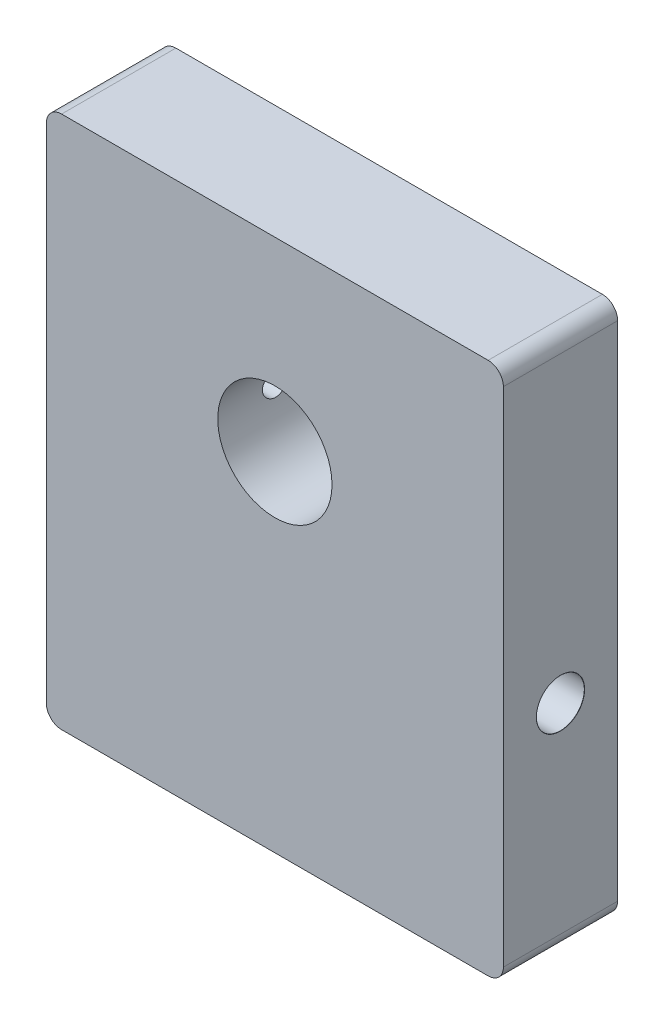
SolidWorks part; units mm, degrees
ref_plane "Front Plane" through (0, 0, 0) normal (0, 0, 1) x (1, 0, 0)
ref_plane "Top Plane" through (0, 0, 0) normal (0, 1, 0) x (1, 0, 0)
ref_plane "Right Plane" through (0, 0, 0) normal (1, 0, 0) x (0, 0, -1)
sketch "Sketch1" plane through (0, 0, 0) normal (0, 0, 1) x (1, 0, 0)
  line L1 (0, 0) -> (76.2, 0)
  line L2 (0, 0) -> (0, 88.9)
  line L3 (0, 88.9) -> (76.2, 88.9)
  line L4 (76.2, 0) -> (76.2, 88.9)
  dimension "D1" = 76.2
  dimension "D2" = 88.9
extrude "Boss-Extrude1" add sketch "Sketch1" along normal blind 19.05
sketch "Sketch2" plane through (0, 0, 19.05) normal (0, 0, 1) x (1, 0, 0)
  line L0 (0, 0) -> (76.2, 0) construction
  line L1 (0, 88.9) -> (0, 0) construction
  circle A0 centre (38.1, 57.912) radius 9.525
  dimension "D3" = 19.05
  dimension "D1" = 57.912
  dimension "D2" = 38.1
extrude "Cut-Extrude1" cut sketch "Sketch2" against normal through all contours A0
hole_wizard "Ø8.0mm Dowel Hole1" positions "Sketch6" profile "Sketch5" hole size "Ø8.0" standard "ANSI Metric"
sketch "Sketch6" plane through (76.2, 0, 0) normal (1, 0, 0) x (0, 0, -1)
  line L0 (-9.525, 0) -> (-9.525, 59.6474) construction
  line L1 (-19.05, 0) -> (0, 0) construction
  point P0 (-9.525, 35.8934)
sketch "Sketch5" plane through (76.2, 35.8934, 9.525) normal (0, 1, 0) x (0, 0, -1)
  line L0 (0, 0) -> (0, 27.8034)
  line L1 (0, 27.8034) -> (4, 25.4)
  line L2 (4, 25.4) -> (4, 0.025)
  line L3 (4, 0.025) -> (4.025, 0)
  line L5 (4.025, 0) -> (0, 0)
  line L6 (-4, 0.025) -> (-4.025, 0) construction
  line L10 (0, 27.8034) -> (-4, 25.4) construction
  line L11 (0, -6.35) -> (0, 107.95) construction
  dimension "Hole Dia." = 8
  dimension "Hole Depth" = 25.4
  dimension "Near C'Sink Dia." = 8.05
  dimension "Near C'Sink Angle" = 90
  dimension "Drill Angle" = 118
sketch "Sketch7" plane through (0, 0, 19.05) normal (0, 0, 1) x (1, 0, 0)
  line L1 (38.1, 63.5) -> (76.2, 63.5)
  line L2 (38.1, 63.5) -> (38.1, 88.9)
  line L3 (38.1, 88.9) -> (76.2, 88.9)
  line L4 (76.2, 63.5) -> (76.2, 88.9)
  dimension "D1" = 38.1
  dimension "D2" = 25.4
extrude "Cut-Extrude2" [suppressed] cut sketch "Sketch7" against normal through all
fillet "Fillet1" radius 2.54 4 edges at (0, 0, 9.525) (76.2, 0, 9.525) (76.2, 88.9, 9.525) (0, 88.9, 9.525)
sketch "Sketch10" plane through (0, 0, 19.05) normal (0, 0, 1) x (1, 0, 0)
  line L0 (50.8, 88.9) -> (50.8, 76.2)
  line L1 (73.66, 88.9) -> (2.54, 88.9) construction
  line L2 (50.8, 76.2) -> (76.2, 76.2)
  line L3 (76.2, 2.54) -> (76.2, 86.36) construction
  line L4 (76.2, 76.2) -> (76.2, 86.36)
  line L6 (73.66, 88.9) -> (50.8, 88.9)
  line L8 (76.2, 86.36) -> (76.2, 88.9)
  line L9 (76.2, 88.9) -> (73.66, 88.9)
  dimension "D1" = 12.7
  dimension "D2" = 25.4
sketch "Sketch11" plane through (0, 0, 0) normal (0, -1, 0) x (1, 0, 0)
  line L0 (73.66, 9.525) -> (2.54, 9.525) construction
  line L1 (73.66, 0) -> (73.66, 19.05) construction
  line L2 (2.54, 19.05) -> (2.54, 0) construction
  line L3 (38.1, 0) -> (38.1, 19.05) construction
  line L4 (2.54, 0) -> (73.66, 0) construction
  line L5 (2.54, 19.05) -> (73.66, 19.05) construction
hole_wizard "Ø8.2 (8.2) Diameter Hole1" positions "Sketch12" profile "Sketch13" hole size "Ø8.2" standard "ANSI Metric"
sketch "Sketch12" plane through (0, 0, 0) normal (0, -1, 0) x (-1, 0, 0)
  line L0 (-73.66, -9.525) -> (-2.54, -9.525) construction
  point P0 (-38.1, -9.525)
sketch "Sketch13" plane through (38.1, 0, 9.525) normal (1, 0, 0) x (0, 0, -1)
  line L0 (0, 0) -> (0, 27.8635)
  line L1 (0, 27.8635) -> (4.1, 25.4)
  line L2 (4.1, 25.4) -> (4.1, 0.025)
  line L3 (4.1, 0.025) -> (4.125, 0)
  line L5 (4.125, 0) -> (0, 0)
  line L6 (-4.1, 0.025) -> (-4.125, 0) construction
  line L10 (0, 27.8635) -> (-4.1, 25.4) construction
  line L11 (0, -6.35) -> (0, 107.95) construction
  dimension "Hole Dia." = 8.2
  dimension "Hole Depth" = 25.4
  dimension "Near C'Sink Dia." = 8.25
  dimension "Near C'Sink Angle" = 90
  dimension "Drill Angle" = 118
sketch "Sketch14" plane through (0, 0, 0) normal (-1, 0, 0) x (0, 0, 1)
  line L0 (0, 2.54) -> (19.05, 2.54) construction
  line L1 (9.525, 2.54) -> (9.525, 90.1429) construction
  line L2 (0, 88.9) -> (19.05, 88.9) construction
  circle A0 centre (9.525, 58.42) radius 2.0998
  dimension "D1" = 30.48
extrude "Cut-Extrude3" cut sketch "Sketch14" against normal blind 38.1
